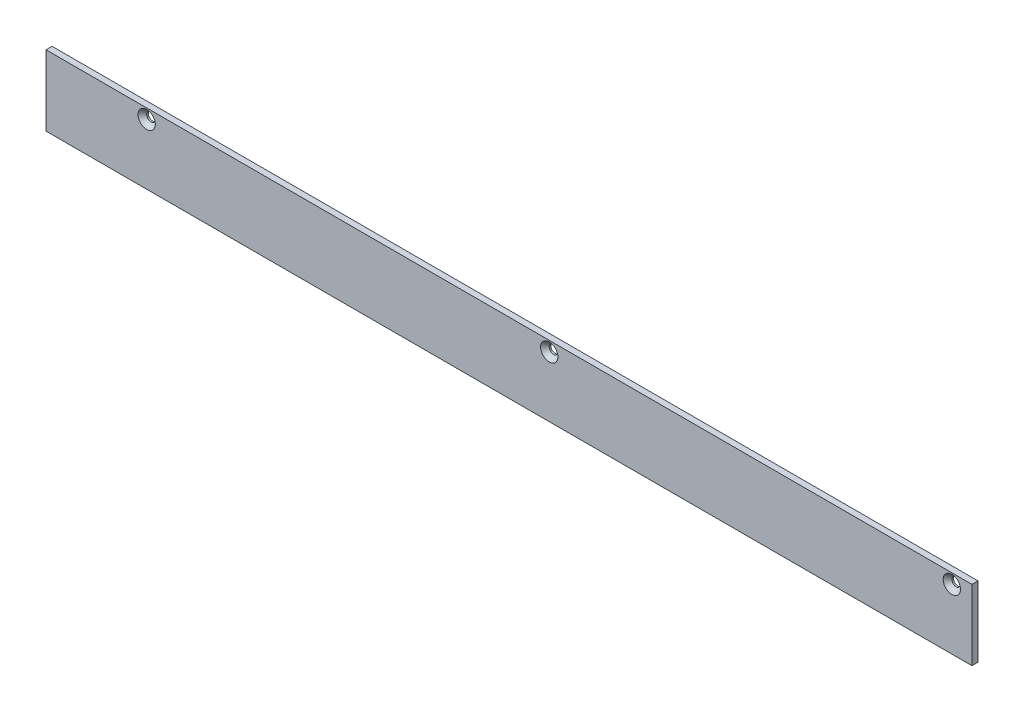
SolidWorks part; units mm, degrees
ref_plane "Спереди" through (0, 0, 0) normal (0, 0, 1) x (1, 0, 0)
ref_plane "Сверху" through (0, 0, 0) normal (0, 1, 0) x (1, 0, 0)
ref_plane "Справа" through (0, 0, 0) normal (1, 0, 0) x (0, 0, -1)
sketch "Эскиз2" plane through (0, 0, 0) normal (0, 0, 1) x (1, 0, 0)
  line L1 (0, 0) -> (460, 0)
  line L2 (0, 0) -> (0, 35)
  line L3 (0, 35) -> (460, 35)
  line L4 (460, 0) -> (460, 35)
  dimension "D1" = 35
  dimension "D2" = 460
extrude "Бобышка-Вытянуть1" add sketch "Эскиз2" along normal blind 3
sketch "Эскиз3" plane through (0, 0, 3) normal (0, 0, 1) x (1, 0, 0)
  line L0 (0, 35) -> (0, 0) construction
  line L1 (460, 35) -> (0, 35) construction
  circle A0 centre (50, 30) radius 4.3
  circle A1 centre (250, 30) radius 4.3
  circle A2 centre (450, 30) radius 4.3
  dimension "D1" = 8.6
  dimension "D2" = 8.6
  dimension "D3" = 8.6
  dimension "D6" = 5
  dimension "D8" = 200
  dimension "D4" = 50
  dimension "D5" = 5
  dimension "D7" = 5
  dimension "D9" = 200
extrude "Вырез-Вытянуть1" cut sketch "Эскиз3" against normal blind 2.15
draft "Уклон1" type of draft neutral plane draft angle 45 faces to draft 3 parameters "D1"=45
sketch "Эскиз4" plane through (0, 0, 0.85) normal (0, 0, 1) x (1, 0, 0)
  circle A0 centre (50, 30) radius 2.15
  dimension "D1" = 4.3
extrude "Вырез-Вытянуть2" cut sketch "Эскиз4" against normal through all
sketch "Эскиз5" plane through (0, 0, 0.85) normal (0, 0, 1) x (1, 0, 0)
  circle A0 centre (250, 30) radius 2.15
  dimension "D1" = 4.3
extrude "Вырез-Вытянуть3" cut sketch "Эскиз5" against normal through all
sketch "Эскиз6" plane through (0, 0, 0.85) normal (0, 0, 1) x (1, 0, 0)
  circle A0 centre (450, 30) radius 2.15
  dimension "D1" = 4.3
extrude "Вырез-Вытянуть4" cut sketch "Эскиз6" against normal through all
